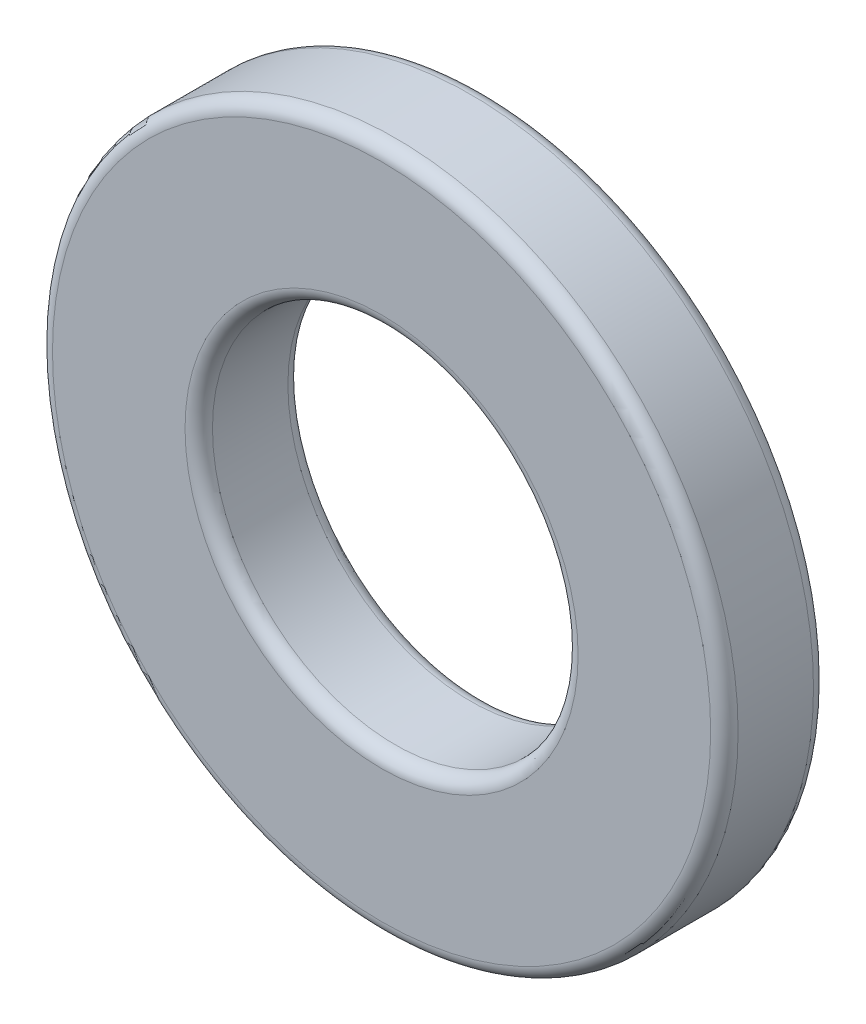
SolidWorks part; units mm, degrees
ref_plane "Front Plane" through (0, 0, 0) normal (0, 0, 1) x (1, 0, 0)
ref_plane "Top Plane" through (0, 0, 0) normal (0, 1, 0) x (1, 0, 0)
ref_plane "Right Plane" through (0, 0, 0) normal (1, 0, 0) x (0, 0, -1)
sketch "Sketch1" plane through (0, 0, 0) normal (0, 0, 1) x (1, 0, 0)
  circle A0 centre (0, 0) radius 6 construction
  circle A1 centre (0, 0) radius 3.2 construction
  point P5 (0, -6)
sketch "Sketch2" plane through (0, 0, 0) normal (1, 0, 0) x (0, 0, -1)
  line L0 (0.7, 0) -> (-0.7, 0) construction
  line L1 (-0.9, -6) -> (0.9, -6) construction
  point P0 (-0.9, -6)
  point P3 (0.9, -6)
  point P4 (0, 0)
  point P9 (0, -6)
  point P10 (0.7, -6)
  point P11 (-0.9, -6)
  point P12 (-0.7, -6)
  point P13 (0.9, -6)
  dimension "Thickness Range [Min]" = 1.4
  dimension "Thickness Range [Max]" = 1.8
sketch "Sketch3" plane through (0, 0, 0) normal (0, 0, 1) x (1, 0, 0)
  circle A0 centre (0, 0) radius 3.2 construction
  circle A1 centre (0, 0) radius 6 construction
  circle A2 centre (0, 0) radius 3.2
  circle A3 centre (0, 0) radius 6
extrude "Boss-Extrude1" add sketch "Sketch3" against normal up to vertex (0.9 mm away) and the other way up to vertex (0.9 mm away)
fillet "Fillet1" radius 0.24 4 edges at (6, 0, -0.9) (3.2, 0, -0.9) (3.2, 0, 0.9) (6, 0, 0.9)
equation "\"D1@Fillet1\"=\"OD@Sketch1\"*.02"
